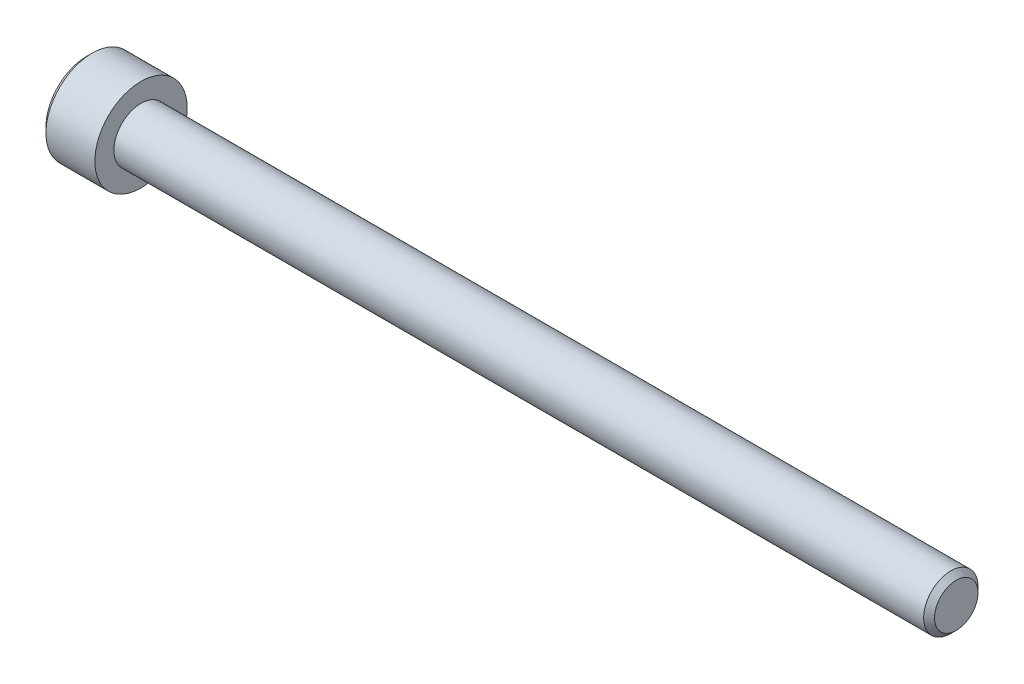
SolidWorks part; units mm, degrees
ref_plane "正面" through (0, 0, 0) normal (0, 0, 1) x (1, 0, 0)
ref_plane "平面" through (0, 0, 0) normal (0, 1, 0) x (1, 0, 0)
ref_plane "右側面" through (0, 0, 0) normal (1, 0, 0) x (0, 0, -1)
imported_body "ｲﾝﾎﾟｰﾄ1"
sketch "ｽｹｯﾁ1" plane through (0, 0, 0) normal (1, 0, 0) x (0, 0, -1)
  circle A0 centre (0, 0) radius 2.5
  point P2 (0, 0)
  dimension "D1" = 5
extrude "ﾎﾞｽ - 押し出し1" add sketch "ｽｹｯﾁ1" along normal blind 75
chamfer "面取り1" distance 0.5 angle 45 1 edges at (75, 0, -2.5)
